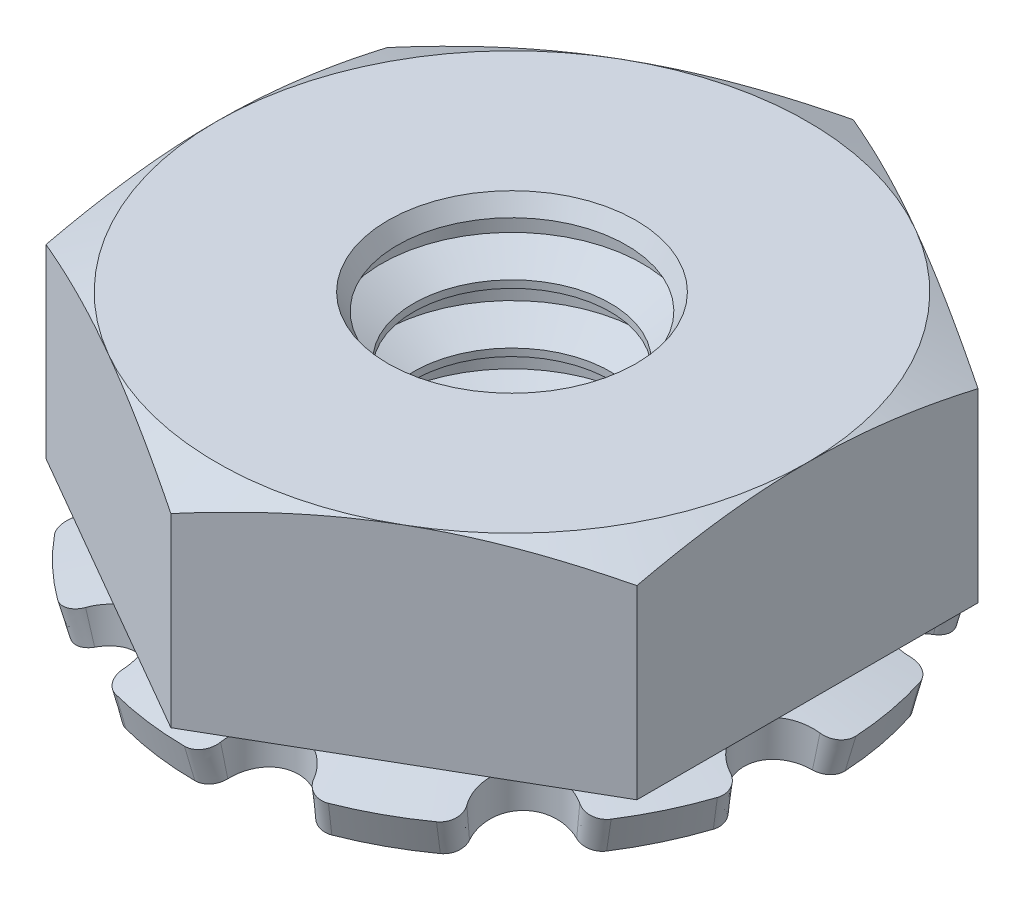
SolidWorks part; units mm, degrees
ref_plane "Front" through (0, 0, 0) normal (0, 0, 1) x (1, 0, 0)
ref_plane "Top" through (0, 0, 0) normal (0, 1, 0) x (1, 0, 0)
ref_plane "Right" through (0, 0, 0) normal (1, 0, 0) x (0, 0, -1)
sketch "Sketch1" plane through (0, 0, 0) normal (0, 1, 0) x (1, 0, 0)
  line L1 (0, 4.5827) -> (-3.9688, 2.2914)
  line L2 (-3.9688, 2.2914) -> (-3.9688, -2.2914)
  line L3 (-3.9688, -2.2914) -> (0, -4.5827)
  line L4 (0, -4.5827) -> (3.9687, -2.2914)
  line L5 (3.9687, -2.2914) -> (3.9687, 2.2914)
  line L6 (3.9687, 2.2914) -> (0, 4.5827)
  circle A0 centre (0, 0) radius 3.9688 construction
  dimension "Hex Flats" = 7.9375
extrude "Extrude1" add sketch "Sketch1" along normal mid plane 2.7781
sketch "Sketch2" plane through (0, 0, 0) normal (1, 0, 0) x (0, 0, -1)
  line L0 (3.9688, 1.3891) -> (4.5827, 1.3891)
  line L1 (4.5827, 1.3891) -> (4.5827, 1.1028)
  line L2 (4.5827, 1.1028) -> (3.9688, 1.3891)
  line L3 (4.5827, 1.3891) -> (4.5827, -1.3891) construction
  line L4 (2.2914, 1.3891) -> (4.5827, 1.3891) construction
  line L5 (0, 1.4214) -> (0, -1.4641) construction
  dimension "D1" = 25
  dimension "D2" = 7.9375
revolve "Cut-Revolve1" cut sketch "Sketch2" angle 360 about L5
sketch "Sketch3" plane through (0, 0, 0) normal (0, 0, 1) x (1, 0, 0)
  line L0 (0, 1.6421) -> (0, -1.6051) construction
  line L1 (1.323, 1.2898) -> (1.323, 1.3891)
  line L2 (1.323, 1.2898) -> (1.7526, 1.0418)
  line L3 (1.7526, 1.0418) -> (1.7526, 0.8434)
  line L4 (1.7526, 0.8434) -> (1.323, 0.5953)
  line L5 (1.323, 1.3891) -> (0, 1.3891)
  line L6 (1.7526, 0.9426) -> (1.323, 0.9426) construction
  line L8 (0, 1.3891) -> (0, 0.5953)
  line L9 (0, 0.5953) -> (1.323, 0.5953)
  line L10 (1.323, 0.5953) -> (1.323, 1.2898) construction
  line L12 (1.9844, 1.3891) -> (-1.9844, 1.3891) construction
  dimension "D1" = 60
  dimension "D2" = 0.0992
  dimension "Major Dia" = 3.5052
  dimension "D4" = 0.1984
  dimension "Pitch" = 0.7937
revolve "Cut-Revolve3" cut sketch "Sketch3" angle 360 about L0
pattern_linear "LPattern2" count 4 spacing 0.7937 along (0, -1, 0)
sketch "Sketch4" plane through (0, 0, 0) normal (0, 0, 1) x (1, 0, 0)
  line L0 (1.5378, 1.1658) -> (1.6667, 1.3891)
  line L1 (1.7526, 1.0418) -> (1.323, 1.2898) construction
  line L2 (1.6667, 1.3891) -> (1.323, 1.3891)
  line L3 (1.323, 1.3891) -> (1.323, 1.2898)
  line L5 (1.323, 1.2898) -> (1.5378, 1.1658)
  line L9 (1.323, 1.2898) -> (1.323, 1.3891) construction
  line L10 (1.9844, 1.3891) -> (-1.9844, 1.3891) construction
  line L11 (0, 1.7859) -> (0, 1.3304) construction
  line L12 (0, 0.0496) -> (0, -0.1984) construction
revolve "Cut-Revolve4" cut sketch "Sketch4" angle 360 about L11
sketch "Sketch12" plane through (0, 0, 0) normal (1, 0, 0) x (0, 0, -1)
  line L0 (0, 1.6201) -> (0, -1.5191) construction
  line L1 (2.2705, -1.4537) -> (3.3362, -1.4537)
  line L2 (3.3362, -1.4537) -> (4.3656, -1.7295)
  line L3 (4.3656, -1.7295) -> (4.2442, -2.1828)
  line L4 (4.2442, -2.1828) -> (3.2148, -1.907)
  line L5 (3.2148, -1.907) -> (1.7526, -1.907)
  line L6 (1.7526, -1.3891) -> (1.7526, -1.907)
  line L7 (1.7526, 0.8434) -> (1.7526, 1.0418) construction
  line L8 (3.437, 1.3891) -> (0, 1.3891) construction
  line L10 (2.2705, -1.3891) -> (2.2705, -1.4537)
  line L11 (2.2705, -1.3891) -> (1.7526, -1.3891)
  line L12 (-2.2914, -1.3891) -> (2.2914, -1.3891) construction
  line L14 (3.3362, -1.4537) -> (3.2148, -1.907) construction
  dimension "D1" = 3.5719
  dimension "Washer Dia" = 8.7312
  dimension "D2" = 165
  dimension "D3" = 0.4693
  dimension "D4" = 0.0646
revolve "Revolve1" add sketch "Sketch12" angle 360 about L0
sketch "Sketch13" plane through (0, -1.907, 0) normal (0, -1, 0) x (1, 0, 0)
  line L0 (4.2169, 1.1299) -> (4.0645, 1.0891)
  line L2 (4.2079, 0) -> (4.3656, 0)
  line L3 (0, 0) -> (4.0121, 1.075) construction
  line L4 (0, 0) -> (4.0604, 0) construction
  arc A0 (4.2169, 1.1299) -> (4.3656, 0) centre (0, 0) cw
  arc A1 (4.0645, 1.0891) -> (4.2079, 0) centre (4.2079, 0.554) ccw
  circle A2 centre (0, 0) radius 4.3656 construction
  circle A3 centre (0, 0) radius 4.2442 construction
  dimension "D1" = 15
extrude "Cut-Extrude2" cut sketch "Sketch13" against normal up to surface and the other way through all
fillet "Fillet1" radius 0.254
pattern_circular "CirPattern6" count 10 over 360
equation "\"D2@Sketch2\" = \"Hex Flats@Sketch1\""
equation "\"D2@Sketch3\" = \"Pitch@Sketch3\"/8"
equation "\"D4@Sketch3\"=\"Pitch@Sketch3\"/4"
equation "\"D3@LPattern2\" = \"Pitch@Sketch3\""
equation "\"D1@LPattern2\"=int(\"Height1@Extrude1\"/\"Pitch@Sketch3\")+1"
equation "\"D4@Sketch12\" = \"D3@Sketch12\"/4"
